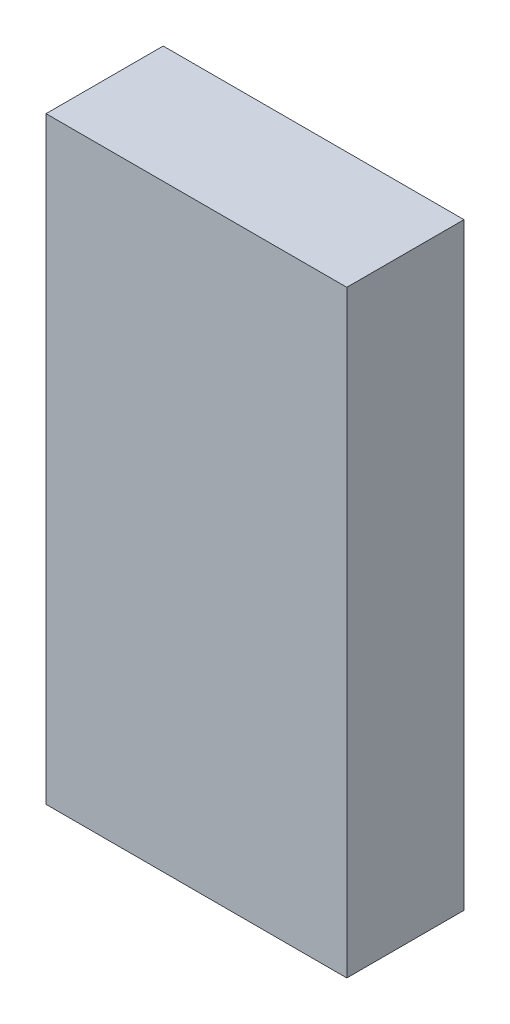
SolidWorks part; units mm, degrees
ref_plane "Front Plane" through (0, 0, 0) normal (1, 0, 0) x (0, 1, 0)
ref_plane "Top Plane" through (0, 0, 0) normal (0, 0, 1) x (0, 1, 0)
ref_plane "Right Plane" through (0, 0, 0) normal (0, 1, 0) x (-1, 0, 0)
sketch "wk w193" plane through (0, 0, 0) normal (0, 0, 1) x (0, 1, 0)
  point P0 (-791.21, -196.596)
  point P3 (-580.39, 0)
  line B0 (-791.21, -196.596) -> (-791.21, -160.02)
  line B1 (-791.21, -160.02) -> (-618.236, -160.02)
  line B2 (-602.996, -144.78) -> (-602.996, 144.78)
  line B3 (-618.236, 160.02) -> (-791.21, 160.02)
  line B4 (-791.21, 160.02) -> (-791.21, 196.596)
  line B5 (-791.21, 196.596) -> (-392.176, 196.596)
  line B6 (-392.176, 196.596) -> (-392.176, 160.02)
  line B7 (-392.176, 160.02) -> (-565.15, 160.02)
  line B8 (-580.39, 144.78) -> (-580.39, -144.78)
  line B9 (-565.15, -160.02) -> (-392.176, -160.02)
  line B10 (-392.176, -160.02) -> (-392.176, -196.596)
  line B11 (-392.176, -196.596) -> (-791.21, -196.596)
  arc B12 (-618.236, -160.02) -> (-602.996, -144.78) centre (-618.236, -144.78) ccw
  arc B13 (-602.996, 144.78) -> (-618.236, 160.02) centre (-618.236, 144.78) ccw
  arc B14 (-565.15, 160.02) -> (-580.39, 144.78) centre (-565.15, 144.78) ccw
  arc B15 (-580.39, -144.78) -> (-565.15, -160.02) centre (-565.15, -144.78) ccw
  dimension "D1" = 580.39
sketch_block_instance "w14x193-2"
sketch_block "w14x193" parameters "D4"=15.24, "D1"=399.034, "D2"=393.192, "D3"=22.606, "D5"=36.576
sketch "Sketch1" plane through (0, 0, 0) normal (0, 0, 1) x (0, 1, 0)
  line L1 (-389.001, 195.596) -> (389.001, 195.596)
  line L2 (-389.001, 195.596) -> (-389.001, -195.596)
  line L3 (-389.001, -195.596) -> (389.001, -195.596)
  line L4 (389.001, 195.596) -> (389.001, -195.596)
  line L5 (-389.001, 195.596) -> (389.001, -195.596) construction
  line L6 (-389.001, -195.596) -> (389.001, 195.596) construction
  line L9 (-791.21, 196.596) -> (-392.176, 196.596) construction
  point P0 (0, 0)
  dimension "D1" = 778.002
  dimension "D2" = 1
extrude "Boss-Extrude1" add sketch "Sketch1" along normal mid plane 152.4
